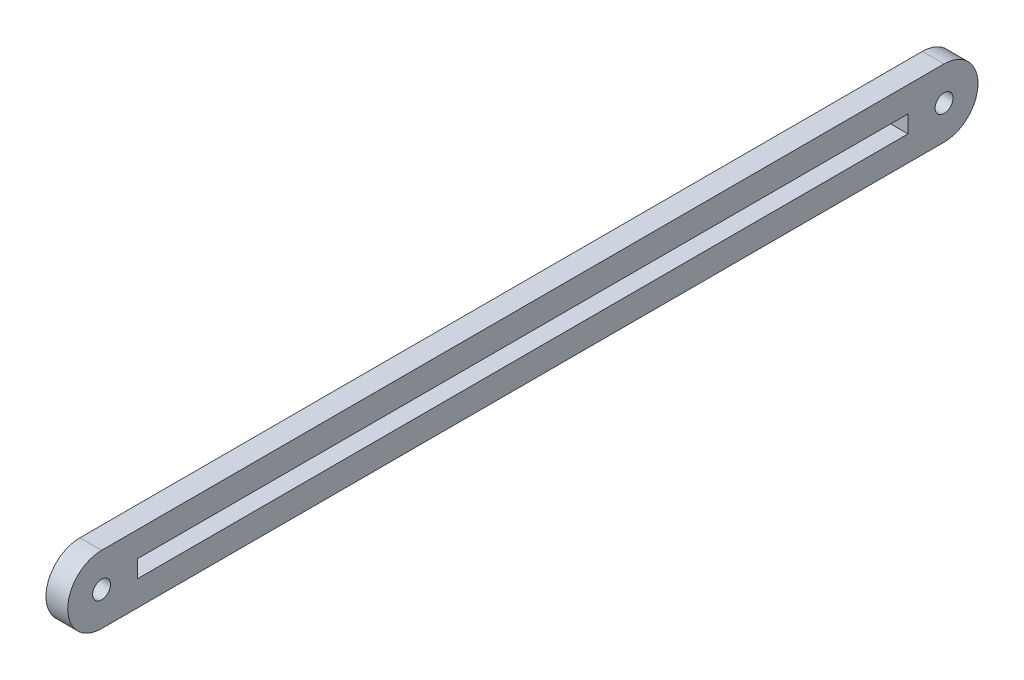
SolidWorks part; units mm, degrees
ref_plane "Alzado" through (0, 0, 0) normal (0, 0, 1) x (1, 0, 0)
ref_plane "Planta" through (0, 0, 0) normal (0, 1, 0) x (1, 0, 0)
ref_plane "Vista lateral" through (0, 0, 0) normal (1, 0, 0) x (0, 0, -1)
sketch "Croquis1" plane through (0, 0, 0) normal (1, 0, 0) x (0, 0, -1)
  line L0 (-77.65, 6.25) -> (77.65, 6.25)
  line L1 (-77.65, -6.25) -> (77.65, -6.25)
  line L2 (0, 0) -> (0, 5.7115) construction
  line L4 (-71, -1.6) -> (71, -1.6)
  line L5 (-71, -1.6) -> (-71, 1.6)
  line L6 (-71, 1.6) -> (71, 1.6)
  line L7 (71, -1.6) -> (71, 1.6)
  line L8 (-71, -1.6) -> (71, 1.6) construction
  line L9 (-71, 1.6) -> (71, -1.6) construction
  arc A0 (-77.65, 6.25) -> (-77.65, -6.25) centre (-77.65, 0) ccw
  circle A1 centre (-77.65, 0) radius 1.65
  circle A2 centre (77.65, 0) radius 1.65
  arc A3 (77.65, 6.25) -> (77.65, -6.25) centre (77.65, 0) cw
  point P13 (0, 6.25)
  point P14 (0, -6.25)
  dimension "D1" = 12.5
  dimension "D2" = 3.3
  dimension "D3" = 142
  dimension "D6" = 4.6
  dimension "D4" = 3.2
  dimension "D5" = 5
extrude "Saliente-Extruir1" add sketch "Croquis1" along normal blind 4
